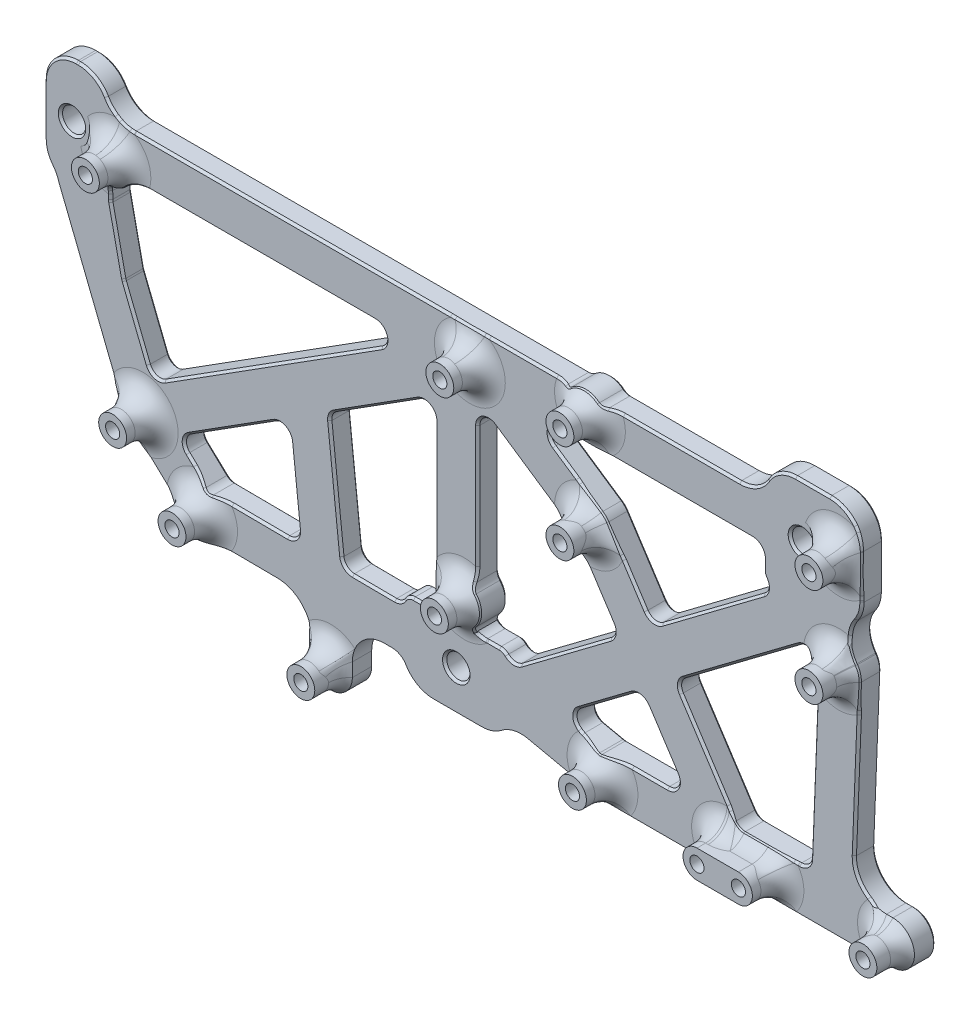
SolidWorks part; units mm, degrees
ref_plane "Płaszczyzna przednia" through (0, 0, 0) normal (0, 0, 1) x (1, 0, 0)
ref_plane "Płaszczyzna górna" through (0, 0, 0) normal (0, 1, 0) x (1, 0, 0)
ref_plane "Płaszczyzna prawa" through (0, 0, 0) normal (1, 0, 0) x (0, 0, -1)
sketch "Szkic1" plane through (0, 0, 0) normal (0, 0, 1) x (1, 0, 0)
  line L0 (-105.8745, -82.9771) -> (-66.5294, -60.2613)
  line L1 (-66.0294, -60.1273) -> (0.7574, -60.1273)
  line L2 (1.2574, -60.2613) -> (40.6024, -82.9771)
  line L3 (157.1383, 126.869) -> (14.6383, -119.9483)
  line L4 (-222.4104, 126.869) -> (-79.9104, -119.9483)
  line L5 (-175.136, 208.7505) -> (109.864, 208.7505)
  line L6 (64.864, 167.3188) -> (64.864, 212.7505)
  line L7 (98.3913, 108.9797) -> (64.9979, 166.8188)
  line L8 (138.1024, 85.8978) -> (98.7574, 108.6137)
  line L9 (-164.0313, 108.6148) -> (-203.3763, 85.8989)
  line L10 (-148.7185, 135.1579) -> (-141.0185, 148.4947)
  line L11 (-130.136, 212.7505) -> (-130.136, 167.3188)
  line L12 (-47.636, 83.7505) -> (-47.636, 178.7505)
  line L13 (-14.8648, 78.9507) -> (67.4076, 31.4507)
  line L14 (-29.8648, 52.97) -> (52.4076, 5.47)
  line L15 (-117.6796, 5.47) -> (-35.4072, 52.97)
  line L16 (-50.4072, 78.9507) -> (-132.6796, 31.4507)
  line L17 (37.7183, 110.8602) -> (37.7183, 136.4102)
  line L18 (37.7183, 136.4102) -> (71.4183, 136.4102)
  line L19 (71.4183, 136.4102) -> (71.4183, 110.8602)
  line L20 (71.4183, 110.8602) -> (37.7183, 110.8602)
  line L21 (-0.9299, 110.8602) -> (-0.9299, 136.4102)
  line L22 (-0.9299, 136.4102) -> (32.7701, 136.4102)
  line L23 (32.7701, 136.4102) -> (32.7701, 110.8602)
  line L24 (32.7701, 110.8602) -> (-0.9299, 110.8602)
  line L25 (56.9957, 168.9767) -> (-2.0043, 168.9767)
  line L26 (-5.0043, 171.9767) -> (-5.0043, 195.9767)
  line L27 (-2.0043, 198.9767) -> (56.9957, 198.9767)
  line L28 (59.9957, 195.9767) -> (59.9957, 171.9767)
  line L29 (-130.136, -7.5388) -> (-130.136, 102.4612)
  line L30 (-130.136, 102.4612) -> (64.864, 102.4612)
  line L31 (64.864, 102.4612) -> (64.864, -7.5388)
  line L32 (64.864, -7.5388) -> (-130.136, -7.5388)
  line L33 (-175.136, 178.7505) -> (109.864, 178.7505)
  line L34 (-196.4296, 141.869) -> (-53.9296, -104.9483)
  line L35 (131.1576, 141.869) -> (-11.3424, -104.9483)
  line L36 (-117.1006, 190.7261) -> (-117.1006, 155.6625)
  line L37 (-113.9256, 193.9011) -> (-117.1006, 190.7261)
  line L38 (-15.5006, 193.9011) -> (-113.9256, 193.9011)
  line L39 (-15.5006, 140.6881) -> (-15.5006, 193.9011)
  line L40 (-112.5695, 140.6881) -> (-15.5006, 140.6881)
  line L41 (-114.8555, 142.9741) -> (-112.5695, 140.6881)
  line L42 (-114.8555, 153.4174) -> (-114.8555, 142.9741)
  line L43 (-117.1006, 155.6625) -> (-114.8555, 153.4174)
  line L44 (-79.0859, -20.1918) -> (-82.0859, -20.1918)
  line L45 (-82.0859, -20.1918) -> (-82.0859, -34.6918)
  line L46 (-82.0859, -34.6918) -> (-79.0859, -34.6918)
  line L47 (-79.0859, -34.6918) -> (-79.0859, -37.6918)
  line L48 (-79.0859, -37.6918) -> (-82.0859, -37.6918)
  line L49 (-82.0859, -37.6918) -> (-82.0859, -37.9418)
  line L50 (-82.0859, -37.9418) -> (-39.0859, -37.9418)
  line L51 (-39.0859, -37.9418) -> (-39.0859, -37.6918)
  line L52 (-39.0859, -37.6918) -> (-42.0859, -37.6918)
  line L53 (-42.0859, -37.6918) -> (-42.0859, -34.6918)
  line L54 (-42.0859, -34.6918) -> (-39.0859, -34.6918)
  line L55 (-39.0859, -34.6918) -> (-39.0859, -20.1918)
  line L56 (-39.0859, -20.1918) -> (-42.0859, -20.1918)
  line L57 (-42.0859, -20.1918) -> (-42.0859, -17.1918)
  line L58 (-42.0859, -17.1918) -> (-39.0859, -17.1918)
  line L59 (-39.0859, -17.1918) -> (-39.0859, -16.9418)
  line L60 (-39.0859, -16.9418) -> (-82.0859, -16.9418)
  line L61 (-82.0859, -16.9418) -> (-82.0859, -17.1918)
  line L62 (-82.0859, -17.1918) -> (-79.0859, -17.1918)
  line L63 (-79.0859, -17.1918) -> (-79.0859, -20.1918)
  line L64 (-95.3418, 129.3922) -> (-98.3418, 129.3922)
  line L65 (-98.3418, 129.3922) -> (-98.3418, 114.8922)
  line L66 (-98.3418, 114.8922) -> (-95.3418, 114.8922)
  line L67 (-95.3418, 114.8922) -> (-95.3418, 111.8922)
  line L68 (-95.3418, 111.8922) -> (-98.3418, 111.8922)
  line L69 (-98.3418, 111.8922) -> (-98.3418, 111.6422)
  line L70 (-98.3418, 111.6422) -> (-55.3418, 111.6422)
  line L71 (-55.3418, 111.6422) -> (-55.3418, 111.8922)
  line L72 (-55.3418, 111.8922) -> (-58.3418, 111.8922)
  line L73 (-58.3418, 111.8922) -> (-58.3418, 114.8922)
  line L74 (-58.3418, 114.8922) -> (-55.3418, 114.8922)
  line L75 (-55.3418, 114.8922) -> (-55.3418, 129.3922)
  line L76 (-55.3418, 129.3922) -> (-58.3418, 129.3922)
  line L77 (-58.3418, 129.3922) -> (-58.3418, 132.3922)
  line L78 (-58.3418, 132.3922) -> (-55.3418, 132.3922)
  line L79 (-55.3418, 132.3922) -> (-55.3418, 132.6422)
  line L80 (-55.3418, 132.6422) -> (-98.3418, 132.6422)
  line L81 (-98.3418, 132.6422) -> (-98.3418, 132.3922)
  line L82 (-98.3418, 132.3922) -> (-95.3418, 132.3922)
  line L83 (-95.3418, 132.3922) -> (-95.3418, 129.3922)
  line L84 (-17.636, 83.7505) -> (-17.636, 178.7505)
  line L85 (-30.1502, 114.2977) -> (-35.3071, 114.2977)
  line L86 (-19.5841, -17.3004) -> (-19.5841, -42.8504)
  line L87 (-19.5841, -42.8504) -> (14.1159, -42.8504)
  line L88 (14.1159, -42.8504) -> (14.1159, -17.3004)
  line L89 (14.1159, -17.3004) -> (-19.5841, -17.3004)
  circle A0 centre (-17.2341, -30.0754) radius 1.65
  circle A1 centre (11.7659, -30.0754) radius 1.65
  circle A2 centre (-68.636, 7.4612) radius 1.65
  circle A3 centre (-68.636, 92.4612) radius 1.65
  circle A4 centre (56.364, 7.4612) radius 1.65
  circle A5 centre (56.364, 92.4612) radius 1.65
  circle A6 centre (61.864, 97.4612) radius 2
  circle A7 centre (-125.136, -2.5388) radius 2
  circle A8 centre (40.0683, 123.6352) radius 1.65
  circle A9 centre (69.0683, 123.6352) radius 1.65
  circle A10 centre (30.4201, 123.6352) radius 1.65
  circle A11 centre (1.4201, 123.6352) radius 1.65
  circle A12 centre (-1.5043, 195.4767) radius 1.25
  circle A13 centre (-1.5043, 172.4767) radius 1.25
  circle A14 centre (56.4957, 195.4767) radius 1.25
  circle A15 centre (56.4957, 172.4767) radius 1.25
  arc A16 (-5.0043, 171.9767) -> (-2.0043, 168.9767) centre (-2.0043, 171.9767) ccw
  arc A17 (-2.0043, 198.9767) -> (-5.0043, 195.9767) centre (-2.0043, 195.9767) ccw
  arc A18 (59.9957, 195.9767) -> (56.9957, 198.9767) centre (56.9957, 195.9767) ccw
  arc A19 (56.9957, 168.9767) -> (59.9957, 171.9767) centre (56.9957, 171.9767) ccw
  circle A20 centre (-105.6706, 143.1011) radius 1.5875
  circle A21 centre (-112.0206, 191.3611) radius 1.5875
  circle A22 centre (-29.4706, 191.3611) radius 1.5875
  circle A23 centre (-30.7406, 143.1011) radius 1.5875
  circle A24 centre (-75.5859, -19.4418) radius 1.5
  circle A25 centre (-45.5859, -35.4418) radius 1.5
  circle A26 centre (-32.636, 109.1294) radius 2.7
  arc A27 (-35.3071, 114.2977) -> (-45.2107, 105.6825) centre (-35.3071, 104.2977) ccw
  arc A28 (-21.6955, 109.638) -> (-30.1502, 114.2977) centre (-30.1502, 104.2977) ccw
  circle A29 centre (-61.8418, 114.1422) radius 1.5
  circle A30 centre (-91.8418, 130.1422) radius 1.5
  dimension "D1" = 30
sketch "Szkic2" plane through (0, 0, 0) normal (0, 0, 1) x (1, 0, 0)
  line L0 (-175.136, 208.7505) -> (109.864, 208.7505) construction
  line L1 (-30.1502, 114.2977) -> (-35.3071, 114.2977) construction
  line L2 (-130.136, 212.7505) -> (-130.136, 167.3188) construction
  line L3 (64.864, 167.3188) -> (64.864, 212.7505) construction
  line L4 (-128.636, 206.2505) -> (-128.636, 181.2505)
  line L5 (-128.636, 181.2505) -> (-113.136, 181.2505)
  line L6 (-113.136, 181.2505) -> (-113.136, 188.7505)
  line L7 (-113.136, 188.7505) -> (-37.636, 188.7505)
  line L8 (-37.636, 188.7505) -> (-37.636, 137.2977)
  line L9 (-37.636, 137.2977) -> (-45.136, 137.2977)
  line L10 (-45.136, 137.2977) -> (-45.136, 119.2977)
  line L11 (-45.136, 119.2977) -> (-20.136, 119.2977)
  line L12 (-20.136, 119.2977) -> (-20.136, 137.2977)
  line L13 (-20.136, 137.2977) -> (-27.636, 137.2977)
  line L14 (-27.636, 137.2977) -> (-27.636, 188.7505)
  line L15 (-27.636, 188.7505) -> (38.864, 188.7505)
  line L16 (38.864, 188.7505) -> (38.864, 181.2505)
  line L17 (38.864, 181.2505) -> (61.864, 181.2505)
  line L18 (61.864, 181.2505) -> (61.864, 206.2505)
  line L19 (61.864, 206.2505) -> (38.864, 206.2505)
  line L20 (38.864, 206.2505) -> (38.864, 198.7505)
  line L21 (38.864, 198.7505) -> (-113.136, 198.7505)
  line L22 (-113.136, 198.7505) -> (-113.136, 206.2505)
  line L23 (-113.136, 206.2505) -> (-128.636, 206.2505)
  line L24 (-128.636, 193.7505) -> (-122.136, 193.7505) construction
  line L25 (-32.636, 128.2977) -> (-32.636, 119.2977) construction
  line L26 (47.864, 193.7505) -> (61.864, 193.7505) construction
  circle A0 centre (-122.136, 193.7505) radius 2.7
  circle A1 centre (47.864, 193.7505) radius 2.7
  circle A2 centre (-32.636, 128.2977) radius 2.7
  dimension "D1" = 5.4
  dimension "D2" = 15
  dimension "D3" = 14
  dimension "D4" = 8
  dimension "D5" = 17
  dimension "D6" = 25
  dimension "D7" = 10
  dimension "D8" = 9
  dimension "D9" = 9
  dimension "D10" = 6.5
  dimension "D11" = 9
  dimension "D12" = 9
  dimension "D13" = 14
extrude "Dodanie-wyciągnięcie1" add sketch "Szkic2" along normal blind 5
sketch "Szkic3" plane through (0, 0, 5) normal (0, 0, 1) x (1, 0, 0)
  line L0 (-120.886, 181.2505) -> (-45.136, 128.2977) construction
  line L1 (-128.636, 181.2505) -> (-113.136, 181.2505) construction
  line L2 (-45.136, 137.2977) -> (-45.136, 119.2977) construction
  line L3 (-118.0213, 185.3485) -> (-42.2713, 132.3957)
  line L4 (-123.7507, 177.1526) -> (-48.0007, 124.1997)
  line L5 (-20.136, 128.2977) -> (50.364, 181.2505) construction
  line L6 (-20.136, 119.2977) -> (-20.136, 137.2977) construction
  line L7 (38.864, 181.2505) -> (61.864, 181.2505) construction
  line L8 (-23.1388, 132.2956) -> (47.3612, 185.2484)
  line L9 (-17.1332, 124.2999) -> (53.3668, 177.2527)
  arc A0 (-118.0213, 185.3485) -> (-123.7507, 177.1526) centre (-120.886, 181.2505) ccw
  arc A1 (-48.0007, 124.1997) -> (-42.2713, 132.3957) centre (-45.136, 128.2977) ccw
  arc A2 (-23.1388, 132.2956) -> (-17.1332, 124.2999) centre (-20.136, 128.2977) ccw
  arc A3 (53.3668, 177.2527) -> (47.3612, 185.2484) centre (50.364, 181.2505) ccw
  point P6 (-83.011, 154.7741)
  point P11 (15.114, 154.7741)
  dimension "D1" = 5
  dimension "D2" = 5
extrude "Dodanie-wyciągnięcie2" add sketch "Szkic3" against normal up to surface (5 mm away)
sketch "Szkic4" plane through (0, 0, 5) normal (0, 0, 1) x (1, 0, 0)
  line L0 (69.0683, 123.6352) -> (1.4201, 123.6352) construction
  line L1 (69.0683, 118.6352) -> (1.4201, 118.6352)
  line L2 (69.0683, 128.6352) -> (1.4201, 128.6352)
  line L3 (-61.8418, 114.1422) -> (-91.8418, 130.1422) construction
  line L4 (-64.1948, 109.7304) -> (-94.1948, 125.7304)
  line L5 (-59.4889, 118.554) -> (-89.4889, 134.554)
  arc A0 (69.0683, 118.6352) -> (69.0683, 128.6352) centre (69.0683, 123.6352) ccw
  arc A1 (1.4201, 128.6352) -> (1.4201, 118.6352) centre (1.4201, 123.6352) ccw
  arc A2 (-64.1948, 109.7304) -> (-59.4889, 118.554) centre (-61.8418, 114.1422) ccw
  arc A3 (-89.4889, 134.554) -> (-94.1948, 125.7304) centre (-91.8418, 130.1422) ccw
  circle A4 centre (-105.6706, 143.1011) radius 5
  circle A5 centre (-1.5043, 172.4767) radius 5
  circle A6 centre (56.4957, 172.4767) radius 5
  circle A7 centre (-1.5043, 195.4767) radius 5
  circle A8 centre (-29.4706, 191.3611) radius 5
  circle A9 centre (-30.7406, 143.1011) radius 5
  circle A10 centre (-112.0206, 191.3611) radius 5
  point P4 (35.2442, 123.6352)
  point P9 (-76.8418, 122.1422)
  dimension "D3" = 10
  dimension "D1" = 10
  dimension "D2" = 10
extrude "Dodanie-wyciągnięcie3" add sketch "Szkic4" against normal up to surface (5 mm away)
sketch "Szkic5" plane through (0, 0, 5) normal (0, 0, 1) x (1, 0, 0)
  line L0 (-91.8418, 130.1422) -> (-105.6706, 143.1011) construction
  line L1 (-95.2607, 126.4938) -> (-109.0895, 139.4527)
  line L2 (-88.4229, 133.7906) -> (-102.2517, 146.7495)
  line L3 (-61.8418, 114.1422) -> (-45.136, 128.2977) construction
  line L4 (-65.0742, 117.9569) -> (-48.3684, 132.1124)
  line L5 (-58.6095, 110.3275) -> (-41.9037, 124.483)
  line L6 (1.4201, 123.6352) -> (-20.136, 128.2977) construction
  line L7 (0.3631, 118.7482) -> (-21.1931, 123.4107)
  line L8 (2.4772, 128.5222) -> (-19.079, 133.1847)
  line L9 (30.4201, 123.6352) -> (-1.5043, 172.4767) construction
  line L10 (26.2348, 120.8995) -> (-5.6896, 169.7411)
  line L11 (34.6054, 126.3708) -> (2.6809, 175.2123)
  line L12 (54.5683, 123.6352) -> (56.4957, 172.4767) construction
  line L13 (49.5722, 123.8323) -> (51.4996, 172.6739)
  line L14 (59.5644, 123.438) -> (61.4918, 172.2796)
  line L15 (40.0683, 123.6352) -> (69.0683, 123.6352) construction
  arc A0 (-95.2607, 126.4938) -> (-88.4229, 133.7906) centre (-91.8418, 130.1422) ccw
  arc A1 (-102.2517, 146.7495) -> (-109.0895, 139.4527) centre (-105.6706, 143.1011) ccw
  arc A2 (-65.0742, 117.9569) -> (-58.6095, 110.3275) centre (-61.8418, 114.1422) ccw
  arc A3 (-41.9037, 124.483) -> (-48.3684, 132.1124) centre (-45.136, 128.2977) ccw
  arc A4 (0.3631, 118.7482) -> (2.4772, 128.5222) centre (1.4201, 123.6352) ccw
  arc A5 (-19.079, 133.1847) -> (-21.1931, 123.4107) centre (-20.136, 128.2977) ccw
  arc A6 (26.2348, 120.8995) -> (34.6054, 126.3708) centre (30.4201, 123.6352) ccw
  arc A7 (2.6809, 175.2123) -> (-5.6896, 169.7411) centre (-1.5043, 172.4767) ccw
  arc A8 (49.5722, 123.8323) -> (59.5644, 123.438) centre (54.5683, 123.6352) ccw
  arc A9 (61.4918, 172.2796) -> (51.4996, 172.6739) centre (56.4957, 172.4767) ccw
  point P4 (-98.7562, 136.6216)
  point P9 (-53.4889, 121.22)
  point P18 (-9.358, 125.9665)
  point P29 (14.4579, 148.0559)
  point P36 (55.532, 148.0559)
  point P48 (54.5683, 123.6352)
  dimension "D1" = 5
  dimension "D2" = 5
  dimension "D3" = 5
  dimension "D4" = 5
  dimension "D5" = 5
extrude "Dodanie-wyciągnięcie4" add sketch "Szkic5" against normal up to surface (5 mm away)
sketch "Szkic6" plane through (0, 0, 5) normal (0, 0, 1) x (1, 0, 0)
  line L0 (-1.5043, 172.4767) -> (-29.4706, 191.3611) construction
  line L1 (-4.3024, 168.333) -> (-32.2687, 187.2173)
  line L2 (1.2938, 176.6205) -> (-26.6725, 195.5048)
  line L3 (56.4957, 172.4767) -> (50.364, 181.2505) construction
  line L4 (52.3973, 169.6125) -> (46.2656, 178.3864)
  line L5 (60.594, 175.3409) -> (54.4623, 184.1147)
  line L6 (-105.6706, 143.1011) -> (-120.886, 181.2505) construction
  line L7 (-110.3148, 141.2488) -> (-125.5303, 179.3983)
  line L8 (-101.0264, 144.9534) -> (-116.2418, 183.1028)
  arc A0 (-4.3024, 168.333) -> (1.2938, 176.6205) centre (-1.5043, 172.4767) ccw
  arc A1 (-26.6725, 195.5048) -> (-32.2687, 187.2173) centre (-29.4706, 191.3611) ccw
  arc A2 (52.3973, 169.6125) -> (60.594, 175.3409) centre (56.4957, 172.4767) ccw
  arc A3 (54.4623, 184.1147) -> (46.2656, 178.3864) centre (50.364, 181.2505) ccw
  arc A4 (-110.3148, 141.2488) -> (-101.0264, 144.9534) centre (-105.6706, 143.1011) ccw
  arc A5 (-116.2418, 183.1028) -> (-125.5303, 179.3983) centre (-120.886, 181.2505) ccw
  point P4 (-15.4875, 181.9189)
  point P9 (53.4298, 176.8636)
  point P18 (-113.2783, 162.1758)
  dimension "D1" = 5
  dimension "D2" = 5
  dimension "D3" = 5
extrude "Dodanie-wyciągnięcie5" add sketch "Szkic6" against normal up to surface (5 mm away)
sketch "Szkic7" plane through (0, 0, 5) normal (0, 0, 1) x (1, 0, 0)
  line L0 (-110.0483, 167.5739) -> (-113.136, 181.9335)
  line L1 (-113.136, 181.9335) -> (-45.136, 134.3983)
  line L2 (-45.136, 134.3983) -> (-53.3191, 127.9175)
  line L3 (-53.3191, 127.9175) -> (-110.0483, 167.5739)
extrude "Wytnij-wyciągnięcie1" cut sketch "Szkic7" against normal through all
sketch "Szkic8" plane through (0, 0, 5) normal (0, 0, 1) x (1, 0, 0)
  line L0 (-29.4706, 191.3611) -> (-105.6706, 143.1011) construction
  line L1 (-26.7953, 187.137) -> (-102.9953, 138.877)
  line L2 (-32.1459, 195.5852) -> (-108.3459, 147.3252)
  line L3 (-67.5706, 167.2311) -> (-61.8418, 114.1422) construction
  line L4 (-62.5995, 167.7675) -> (-56.8707, 114.6786)
  line L5 (-72.5417, 166.6947) -> (-66.8129, 113.6058)
  arc A0 (-26.7953, 187.137) -> (-32.1459, 195.5852) centre (-29.4706, 191.3611) ccw
  arc A1 (-108.3459, 147.3252) -> (-102.9953, 138.877) centre (-105.6706, 143.1011) ccw
  arc A2 (-62.5995, 167.7675) -> (-72.5417, 166.6947) centre (-67.5706, 167.2311) ccw
  arc A3 (-66.8129, 113.6058) -> (-56.8707, 114.6786) centre (-61.8418, 114.1422) ccw
  point P4 (-67.5706, 167.2311)
  point P12 (-64.7062, 140.6866)
  dimension "D1" = 10
  dimension "D2" = 10
extrude "Dodanie-wyciągnięcie6" add sketch "Szkic8" against normal up to surface (5 mm away) contours A2 L2 A1 L1 L5 | A2 L4 L1 A0 L2 | L4 A2 L5 L1 | L5 A3 L4 L1
sketch "Szkic9" plane through (0, 0, 5) normal (0, 0, 1) x (1, 0, 0)
  line L0 (-45.136, 121.7441) -> (-45.136, 119.2977) construction
  line L1 (-106.7858, 125.1422) -> (-45.136, 125.1422)
  line L2 (-106.7858, 125.1422) -> (-106.7858, 105.8463)
  line L3 (-106.7858, 105.8463) -> (-45.136, 105.8463)
  line L4 (-45.136, 125.1422) -> (-45.136, 105.8463)
  dimension "D1" = 5
extrude "Wytnij-wyciągnięcie2" cut sketch "Szkic9" against normal through all
sketch "Szkic10" plane through (0, 0, 5) normal (0, 0, 1) x (1, 0, 0)
  line L0 (-45.136, 134.3983) -> (-45.136, 125.1422) construction
  line L1 (-91.8418, 130.1422) -> (-45.136, 129.7702) construction
  line L2 (-91.802, 135.142) -> (-45.0962, 134.7701)
  line L3 (-91.8816, 125.1424) -> (-45.1758, 124.7704)
  line L4 (-61.8418, 114.1422) -> (-61.8418, 129.9033) construction
  line L5 (-66.8418, 114.1422) -> (-66.8418, 129.9033)
  line L6 (-56.8418, 114.1422) -> (-56.8418, 129.9033)
  arc A0 (-91.802, 135.142) -> (-91.8816, 125.1424) centre (-91.8418, 130.1422) ccw
  arc A1 (-45.1758, 124.7704) -> (-45.0962, 134.7701) centre (-45.136, 129.7702) ccw
  arc A2 (-66.8418, 114.1422) -> (-56.8418, 114.1422) centre (-61.8418, 114.1422) ccw
  arc A3 (-56.8418, 129.9033) -> (-66.8418, 129.9033) centre (-61.8418, 129.9033) ccw
  point P4 (-68.4889, 129.9562)
  point P15 (-61.8418, 122.0227)
  dimension "D2" = 5
  dimension "D1" = 10
extrude "Dodanie-wyciągnięcie7" add sketch "Szkic10" against normal up to surface (5 mm away) contours A3 L2 A0 L3 L5 | A3 L6 L3 A1 L2 | L5 A2 L6 L3 | L6 A3 L5 L3
sketch "Szkic11" plane through (0, 0, 5) normal (0, 0, 1) x (1, 0, 0)
  circle A0 centre (-112.0206, 191.3611) radius 3.25
  circle A1 centre (-105.6706, 143.1011) radius 3.25
  circle A2 centre (-91.8418, 130.1422) radius 3.25
  circle A3 centre (-61.8418, 114.1422) radius 3.25
  circle A4 centre (-30.7406, 143.1011) radius 3.25
  circle A5 centre (1.4201, 123.6352) radius 3.25
  circle A6 centre (30.4201, 123.6352) radius 3.25
  circle A7 centre (40.0683, 123.6352) radius 3.25
  circle A8 centre (69.0683, 123.6352) radius 3.25
  circle A9 centre (56.4957, 172.4767) radius 3.25
  circle A11 centre (56.4957, 195.4767) radius 3.25
  circle A12 centre (-1.5043, 172.4767) radius 3.25
  circle A13 centre (-1.5043, 195.4767) radius 3.25
  circle A14 centre (-29.4706, 191.3611) radius 3.25
  dimension "D1" = 6.5
extrude "Dodanie-wyciągnięcie8" add sketch "Szkic11" along normal blind 7
fillet "Zaokrąglenie1" radius 7.5 12 edges at (-56.8418, 124.8633, 2.5) (-66.8418, 124.9429, 2.5) (-93.0918, 125.1422, 2.5) (-45.136, 119.2977, 2.5) (-20.136, 119.2977, 2.5) (59.7695, 128.6352, 2.5) (61.864, 181.2505, 2.5) (61.864, 206.2505, 2.5) (38.864, 206.2505, 2.5) (-113.136, 206.2505, 2.5) (-128.636, 206.2505, 2.5) (-128.636, 181.2505, 2.5)
fillet "Zaokrąglenie2" radius 7.5 6 edges at (38.864, 198.7505, 2.5) (56.464, 181.2505, 2.5) (-45.136, 124.7702, 2.5) (-20.136, 123.1821, 2.5) (-125.886, 181.2505, 2.5) (-113.136, 198.7505, 2.5)
sketch "Szkic12" plane through (0, 0, 5) normal (0, 0, 1) x (1, 0, 0)
  line L0 (-49.2821, 124.8031) -> (-45.1758, 124.7704) construction
  line L1 (-47.55, 124.7893) -> (-45.1758, 124.7704)
  arc A0 (-44.3583, 122.9589) -> (-47.55, 124.7893) centre (-47.5799, 121.0394) ccw
  arc A1 (-44.9772, 124.2719) -> (-37.9153, 119.2977) centre (-37.9153, 126.7977) ccw construction
  arc A2 (-44.9772, 124.2719) -> (-45.1758, 124.7704) centre (-52.039, 121.7461) ccw construction
  arc A3 (-44.9772, 124.2719) -> (-45.1758, 124.7704) centre (-52.039, 121.7461) ccw
  arc A4 (-44.9772, 124.2719) -> (-44.3583, 122.9589) centre (-37.9153, 126.7977) ccw
  dimension "D1" = 7.5
extrude "Dodanie-wyciągnięcie9" add sketch "Szkic12" against normal up to surface (5 mm away)
fillet "Zaokrąglenie3" radius 2.5 31 edges at (49.2296, 174.1452, 2.5) (51.4332, 170.9921, 2.5) (49.7617, 128.6352, 2.5) (33.1253, 128.6352, 2.5) (18.4765, 151.0465, 2.5) (-62.2655, 164.6726, 2.5) (-37.636, 180.2712, 2.5) (-37.636, 137.2977, 2.5) (-45.136, 137.2977, 2.5) (-59.0507, 134.8812, 2.5) (-69.1174, 134.9614, 2.5) (-71.6801, 158.71, 2.5) (-97.5386, 142.3329, 2.5) (-89.8484, 135.1265, 2.5) (-42.9374, 188.7505, 2.5) (-103.2576, 150.5477, 2.5) (-110.0483, 167.5739, 2.5) (-113.136, 181.9335, 2.5) (-107.7562, 188.7505, 2.5) (-113.136, 186.4871, 2.5) (-16.6699, 188.7505, 2.5) (38.864, 188.7505, 2.5) (38.864, 181.2505, 2.5) (12.9936, 159.4348, 2.5) (-20.136, 137.2977, 2.5) (-27.636, 139.1817, 2.5) (-27.636, 147.0205, 2.5) (-5.138, 168.8972, 2.5) (-27.636, 184.0891, 2.5) (2.2748, 198.7505, 2.5) (-5.2835, 198.7505, 2.5)
fillet "Zaokrąglenie4" radius 2.5 8 edges at (21.1786, 128.6352, 2.5) (10.4637, 145.028, 2.5) (-8.384, 130.8714, 2.5) (1.9547, 128.6352, 2.5) (-45.136, 134.7704, 2.5) (-27.636, 137.2977, 2.5) (42.0385, 181.2505, 2.5) (4.9808, 153.4164, 2.5)
fillet "Zaokrąglenie5" radius 2.5 1 edges at (-20.136, 134.551, 2.5)
sketch "Szkic14" plane through (0, 0, 5) normal (0, 0, 1) x (1, 0, 0)
  line L0 (30.4201, 123.6352) -> (40.0683, 123.6352) construction
  line L1 (30.4201, 126.8852) -> (40.0683, 126.8852)
  line L2 (30.4201, 120.3852) -> (40.0683, 120.3852)
  arc A0 (30.4201, 126.8852) -> (30.4201, 120.3852) centre (30.4201, 123.6352) ccw
  arc A1 (40.0683, 120.3852) -> (40.0683, 126.8852) centre (40.0683, 123.6352) ccw
  circle A2 centre (40.0683, 123.6352) radius 3.25 construction
  circle A3 centre (30.4201, 123.6352) radius 3.25 construction
  point P2 (35.2442, 123.6352)
extrude "Dodanie-wyciągnięcie10" add sketch "Szkic14" along normal blind 7
fillet "Zaokrąglenie6" radius 5 15 edges at (-4.7543, 195.4767, 5) (53.2457, 195.4767, 5) (53.2457, 172.4767, 5) (65.8183, 123.6352, 5) (-4.7543, 172.4767, 5) (-32.7206, 191.3611, 5) (-1.8299, 123.6352, 5) (27.1701, 123.6352, 5) (-65.0918, 114.1422, 5) (-33.9906, 143.1011, 5) (-115.2706, 191.3611, 5) (-108.9206, 143.1011, 5) (-95.0918, 130.1422, 5) (35.2442, 126.8852, 5) (43.3183, 123.6352, 5)
sketch "Szkic15" plane through (0, 0, 5) normal (0, 0, 1) x (1, 0, 0)
  circle A0 centre (47.864, 193.7505) radius 4.5
  circle A1 centre (-122.136, 193.7505) radius 4.5
  arc A2 (-119.5886, 194.6455) -> (-120.2584, 191.8104) centre (-122.136, 193.7505) ccw construction
  dimension "D1" = 9
extrude "Wytnij-wyciągnięcie3" cut sketch "Szkic15" along normal through all
hole_wizard "Otwór Ø3.3 (3.3)1" positions "Szkic16" profile "Szkic17" hole size "Ø3.3" standard "DIN"
sketch "Szkic16" plane through (0, 0, 12) normal (0, 0, 1) x (1, 0, 0)
  point P0 (-112.0206, 191.3611)
  point P3 (-105.6706, 143.1011)
  point P6 (-91.8418, 130.1422)
  point P9 (-61.8418, 114.1422)
  point P12 (-30.7406, 143.1011)
  point P15 (1.4201, 123.6352)
  point P18 (30.4201, 123.6352)
  point P21 (40.0683, 123.6352)
  point P24 (69.0683, 123.6352)
  point P27 (-1.5043, 172.4767)
  point P30 (-1.5043, 195.4767)
  point P33 (56.4957, 195.4767)
  point P36 (56.4957, 172.4767)
  point P40 (-29.4706, 191.3611)
sketch "Szkic17" plane through (-112.0206, 191.3611, 12) normal (1, 0, 0) x (0, -1, 0)
  line L0 (0, 0) -> (0, 12)
  line L1 (0, 12) -> (1.65, 12)
  line L2 (1.65, 12) -> (1.65, 0)
  line L5 (1.65, 0) -> (0, 0)
  line L11 (0, -6.35) -> (0, 107.95) construction
  dimension "Średnica otworu na wylot" = 3.3
  dimension "Głębokość otworu na wylot" = 12
sketch "Szkic18" plane through (0, 0, 0) normal (0, 0, -1) x (-1, 0, 0)
  line L1 (-56.4957, 192.1281) -> (-53.5957, 193.8024)
  line L2 (-53.5957, 193.8024) -> (-53.5957, 197.151)
  line L3 (-53.5957, 197.151) -> (-56.4957, 198.8253)
  line L4 (-56.4957, 198.8253) -> (-59.3957, 197.151)
  line L5 (-59.3957, 197.151) -> (-59.3957, 193.8024)
  line L6 (-59.3957, 193.8024) -> (-56.4957, 192.1281)
  line L7 (-56.4957, 169.1281) -> (-53.5957, 170.8024)
  line L8 (-53.5957, 170.8024) -> (-53.5957, 174.151)
  line L9 (-53.5957, 174.151) -> (-56.4957, 175.8253)
  line L10 (-56.4957, 175.8253) -> (-59.3957, 174.151)
  line L11 (-59.3957, 174.151) -> (-59.3957, 170.8024)
  line L12 (-59.3957, 170.8024) -> (-56.4957, 169.1281)
  line L13 (1.5043, 169.1281) -> (4.4043, 170.8024)
  line L14 (4.4043, 170.8024) -> (4.4043, 174.151)
  line L15 (4.4043, 174.151) -> (1.5043, 175.8253)
  line L16 (1.5043, 175.8253) -> (-1.3957, 174.151)
  line L17 (-1.3957, 174.151) -> (-1.3957, 170.8024)
  line L18 (-1.3957, 170.8024) -> (1.5043, 169.1281)
  line L19 (1.5043, 192.1281) -> (4.4043, 193.8024)
  line L20 (4.4043, 193.8024) -> (4.4043, 197.151)
  line L21 (4.4043, 197.151) -> (1.5043, 198.8253)
  line L22 (1.5043, 198.8253) -> (-1.3957, 197.151)
  line L23 (-1.3957, 197.151) -> (-1.3957, 193.8024)
  line L24 (-1.3957, 193.8024) -> (1.5043, 192.1281)
  line L25 (29.875, 188.037) -> (32.5516, 190.0493)
  line L26 (32.5516, 190.0493) -> (32.1472, 193.3734)
  line L27 (32.1472, 193.3734) -> (29.0662, 194.6852)
  line L28 (29.0662, 194.6852) -> (26.3896, 192.6729)
  line L29 (26.3896, 192.6729) -> (26.794, 189.3488)
  line L30 (26.794, 189.3488) -> (29.875, 188.037)
  line L31 (113.9213, 188.6041) -> (115.3585, 191.6286)
  line L32 (115.3585, 191.6286) -> (113.4579, 194.3856)
  line L33 (113.4579, 194.3856) -> (110.1199, 194.118)
  line L34 (110.1199, 194.118) -> (108.6827, 191.0935)
  line L35 (108.6827, 191.0935) -> (110.5833, 188.3366)
  line L36 (110.5833, 188.3366) -> (113.9213, 188.6041)
  line L37 (106.5317, 139.8651) -> (108.9036, 142.2288)
  line L38 (108.9036, 142.2288) -> (108.0425, 145.4649)
  line L39 (108.0425, 145.4649) -> (104.8095, 146.3371)
  line L40 (104.8095, 146.3371) -> (102.4376, 143.9733)
  line L41 (102.4376, 143.9733) -> (103.2987, 140.7373)
  line L42 (103.2987, 140.7373) -> (106.5317, 139.8651)
  line L43 (92.4294, 126.8455) -> (94.9906, 129.0027)
  line L44 (94.9906, 129.0027) -> (94.403, 132.2994)
  line L45 (94.403, 132.2994) -> (91.2542, 133.4389)
  line L46 (91.2542, 133.4389) -> (88.693, 131.2817)
  line L47 (88.693, 131.2817) -> (89.2806, 127.985)
  line L48 (89.2806, 127.985) -> (92.4294, 126.8455)
  line L49 (62.5969, 110.8798) -> (65.0447, 113.1649)
  line L50 (65.0447, 113.1649) -> (64.2896, 116.4273)
  line L51 (64.2896, 116.4273) -> (61.0868, 117.4046)
  line L52 (61.0868, 117.4046) -> (58.639, 115.1195)
  line L53 (58.639, 115.1195) -> (59.394, 111.8571)
  line L54 (59.394, 111.8571) -> (62.5969, 110.8798)
  line L55 (-66.6701, 121.2981) -> (-65.8452, 124.5435)
  line L56 (-65.8452, 124.5435) -> (-68.2434, 126.8806)
  line L57 (-68.2434, 126.8806) -> (-71.4665, 125.9723)
  line L58 (-71.4665, 125.9723) -> (-72.2914, 122.7268)
  line L59 (-72.2914, 122.7268) -> (-69.8932, 120.3897)
  line L60 (-69.8932, 120.3897) -> (-66.6701, 121.2981)
  line L61 (-38.1088, 120.9197) -> (-36.7369, 123.9744)
  line L62 (-36.7369, 123.9744) -> (-38.6964, 126.6899)
  line L63 (-38.6964, 126.6899) -> (-42.0278, 126.3506)
  line L64 (-42.0278, 126.3506) -> (-43.3997, 123.2959)
  line L65 (-43.3997, 123.2959) -> (-41.4402, 120.5805)
  line L66 (-41.4402, 120.5805) -> (-38.1088, 120.9197)
  line L67 (-28.6915, 120.7672) -> (-27.0721, 123.6982)
  line L68 (-27.0721, 123.6982) -> (-28.8007, 126.5662)
  line L69 (-28.8007, 126.5662) -> (-32.1487, 126.5031)
  line L70 (-32.1487, 126.5031) -> (-33.7681, 123.5721)
  line L71 (-33.7681, 123.5721) -> (-32.0395, 120.7042)
  line L72 (-32.0395, 120.7042) -> (-28.6915, 120.7672)
  line L73 (-0.0411, 120.5837) -> (1.9121, 123.3037)
  line L74 (1.9121, 123.3037) -> (0.5331, 126.3552)
  line L75 (0.5331, 126.3552) -> (-2.7991, 126.6867)
  line L76 (-2.7991, 126.6867) -> (-4.7523, 123.9666)
  line L77 (-4.7523, 123.9666) -> (-3.3733, 120.9151)
  line L78 (-3.3733, 120.9151) -> (-0.0411, 120.5837)
  line L79 (32.2694, 140.1218) -> (34.0851, 142.9354)
  line L80 (34.0851, 142.9354) -> (32.5563, 145.9147)
  line L81 (32.5563, 145.9147) -> (29.2118, 146.0804)
  line L82 (29.2118, 146.0804) -> (27.3961, 143.2668)
  line L83 (27.3961, 143.2668) -> (28.9248, 140.2875)
  line L84 (28.9248, 140.2875) -> (32.2694, 140.1218)
  circle A0 centre (-56.4957, 195.4767) radius 2.9 construction
  circle A1 centre (-56.4957, 172.4767) radius 2.9 construction
  circle A2 centre (1.5043, 172.4767) radius 2.9 construction
  circle A3 centre (1.5043, 195.4767) radius 2.9 construction
  circle A4 centre (29.4706, 191.3611) radius 2.9 construction
  circle A5 centre (112.0206, 191.3611) radius 2.9 construction
  circle A6 centre (105.6706, 143.1011) radius 2.9 construction
  circle A7 centre (91.8418, 130.1422) radius 2.9 construction
  circle A8 centre (61.8418, 114.1422) radius 2.9 construction
  circle A9 centre (-69.0683, 123.6352) radius 2.9 construction
  circle A10 centre (-40.0683, 123.6352) radius 2.9 construction
  circle A11 centre (-30.4201, 123.6352) radius 2.9 construction
  circle A12 centre (-1.4201, 123.6352) radius 2.9 construction
  circle A13 centre (30.7406, 143.1011) radius 2.9 construction
  dimension "D1" = 5.8
extrude "Wytnij-wyciągnięcie4" cut sketch "Szkic18" against normal blind 2.6
chamfer "Sfazowanie1" distance 0.6 angle 65 14 edges at (-3.1543, 172.4767, 2.6) (-31.1206, 191.3611, 2.6) (-3.1543, 195.4767, 2.6) (-113.6706, 191.3611, 2.6) (-107.3206, 143.1011, 2.6) (-93.4918, 130.1422, 2.6) (-63.4918, 114.1422, 2.6) (-32.3906, 143.1011, 2.6) (-0.2299, 123.6352, 2.6) (28.7701, 123.6352, 2.6) (38.4183, 123.6352, 2.6) (67.4183, 123.6352, 2.6) (54.8457, 172.4767, 2.6) (54.8457, 195.4767, 2.6)
chamfer "Sfazowanie2" distance 0.5 angle 45 207 edges at (-29.936, 128.2977, 0) (-119.436, 193.7505, 0) (50.564, 193.7505, 0) (1.9562, 128.6493, 0) (-0.6715, 129.2032, 0) (-4.9501, 131.6234, 0) (2.1602, 138.7912, 0) (10.2636, 143.8886, 0) (15.2872, 137.6485, 0) (18.7566, 129.9455, 0) (9.3899, 128.6352, 0) (-26.7972, 137.5118, 0) (-27.4727, 139.0059, 0) (-25.7406, 143.1011, 0) (-27.4727, 147.1963, 0) (-27.636, 163.7347, 0) (-26.3091, 181.592, 0) (-14.6464, 175.3178, 0) (-5.1738, 168.8619, 0) (-0.5813, 161.9259, 0) (-7.2807, 144.2067, 0) (-19.3228, 135.9071, 0) (-21.7022, 137.1168, 0) (-24.2106, 137.2977, 0) (13.1937, 160.5742, 0) (7.1072, 168.4405, 0) (2.0576, 175.9856, 0) (-4.3028, 180.3996, 0) (-10.8909, 186.9821, 0) (13.9318, 188.7505, 0) (38.1317, 188.0183, 0) (38.864, 185.0005, 0) (38.9851, 182.9819, 0) (39.7808, 180.4495, 0) (26.9691, 169.9318, 0) (49.091, 129.3329, 0) (40.9182, 128.6352, 0) (33.2882, 128.9364, 0) (26.0715, 139.4268, 0) (19.3881, 150.8864, 0) (33.755, 162.5222, 0) (49.0566, 173.0613, 0) (50.8314, 171.8533, 0) (51.3009, 170.9533, 0) (50.6282, 150.5939, 0) (-110.0398, 167.5765, 0) (-111.5863, 174.7265, 0) (-113.122, 181.935, 0) (-113.136, 183.0946, 0) (-112.5601, 185.5863, 0) (-109.6086, 186.9813, 0) (-107.5291, 188.5428, 0) (-79.0442, 188.7505, 0) (-49.1561, 186.9469, 0) (-75.4665, 168.1488, 0) (-102.8217, 151.8928, 0) (-107.1718, 160.3618, 0) (-58.4817, 135.5099, 0) (-60.6941, 150.1101, 0) (-61.8647, 164.4793, 0) (-51.2121, 171.673, 0) (-38.9306, 177.9189, 0) (-37.636, 157.7632, 0) (-38.3683, 138.03, 0) (-41.386, 137.2977, 0) (-43.8892, 136.961, 0) (-45.7289, 135.1169, 0) (-51.9086, 134.8243, 0) (-95.9615, 142.1839, 0) (-84.9414, 150.3112, 0) (-72.6489, 156.7012, 0) (-70.3339, 146.2347, 0) (-70.0506, 135.806, 0) (-80.3978, 135.0512, 0) (-89.7801, 135.2974, 0) (-92.8716, 137.9595, 0) (-41.6206, 120.2769, 0) (-32.3111, 119.2977, 0) (-24.2788, 119.7017, 0) (-19.1775, 122.2562, 0) (-7.7844, 120.5105, 0) (0.8886, 118.6635, 0) (35.2442, 118.6352, 0) (74.0683, 123.6352, 0) (68.3198, 128.6352, 0) (62.1645, 130.9375, 0) (60.7845, 154.3552, 0) (61.2936, 173.8838, 0) (60.5348, 175.4257, 0) (59.1231, 179.8224, 0) (61.5132, 186.1836, 0) (61.864, 193.6005, 0) (59.6673, 204.0539, 0) (50.364, 206.2505, 0) (42.614, 205.2457, 0) (37.1236, 199.7554, 0) (18.328, 198.7505, 0) (2.4343, 198.8988, 0) (-1.5043, 200.4767, 0) (-5.443, 198.8988, 0) (-56.9684, 198.7505, 0) (-111.3956, 199.7554, 0) (-116.886, 205.2457, 0) (-120.886, 206.2505, 0) (-126.4393, 204.0539, 0) (-128.636, 192.9026, 0) (-128.2169, 184.5826, 0) (-126.2212, 181.1763, 0) (-125.6114, 179.6163, 0) (-117.9226, 160.3235, 0) (-109.801, 140.2833, 0) (-102.1751, 132.9732, 0) (-94.7529, 126.077, 0) (-92.7927, 125.2934, 0) (-82.8072, 125.0701, 0) (-69.0174, 122.7846, 0) (-66.8418, 115.8223, 0) (-61.8418, 109.1422, 0) (-56.8418, 115.7228, 0) (-54.624, 122.6277, 0) (-48.416, 124.7962, 0) (-45.7143, 124.2924, 0) (55.0457, 192.9652, 0) (53.5957, 195.4767, 0) (55.0457, 197.9882, 0) (57.9457, 197.9882, 0) (59.3957, 195.4767, 0) (57.9457, 192.9652, 0) (-33.1773, 141.5286, 0) (-33.3207, 144.425, 0) (-30.8841, 145.9975, 0) (-28.3039, 144.6736, 0) (-28.1605, 141.7771, 0) (-30.5971, 140.2046, 0) (-0.9355, 121.9437, 0) (-1.2226, 124.8294, 0) (1.133, 126.5209, 0) (3.7757, 125.3266, 0) (4.0628, 122.4409, 0) (1.7072, 120.7494, 0) (27.8818, 122.2327, 0) (27.9364, 125.1322, 0) (30.4747, 126.5347, 0) (32.9584, 125.0376, 0) (32.9038, 122.1382, 0) (30.3655, 120.7357, 0) (37.4229, 122.447, 0) (37.7166, 125.3321, 0) (40.3621, 126.5202, 0) (42.7137, 124.8233, 0) (42.42, 121.9382, 0) (39.7745, 120.7501, 0) (66.2577, 122.9208, 0) (67.0443, 125.7121, 0) (69.855, 126.4264, 0) (71.8789, 124.3495, 0) (71.0923, 121.5583, 0) (68.2817, 120.8439, 0) (-63.8208, 112.0223, 0) (-64.6671, 114.7961, 0) (-62.6882, 116.9159, 0) (-59.8629, 116.2621, 0) (-59.0165, 113.4883, 0) (-60.9954, 111.3685, 0) (-93.71, 127.9241, 0) (-94.6968, 130.6511, 0) (-92.8286, 132.8691, 0) (-89.9736, 132.3603, 0) (-88.9868, 129.6333, 0) (-90.855, 127.4153, 0) (-107.7177, 141.047, 0) (-108.4731, 143.8469, 0) (-106.426, 145.901, 0) (-103.6235, 145.1552, 0) (-102.8681, 142.3553, 0) (-104.9152, 140.3012, 0) (-114.6399, 190.1164, 0) (-114.4082, 193.0071, 0) (-111.7889, 194.2518, 0) (-109.4013, 192.6058, 0) (-109.633, 189.7151, 0) (-112.2523, 188.4704, 0) (-31.2133, 189.0431, 0) (-32.3494, 191.7113, 0) (-30.6067, 194.0293, 0) (-27.7279, 193.6791, 0) (-26.5918, 191.0109, 0) (-28.3345, 188.6929, 0) (-2.9543, 192.9652, 0) (-4.4043, 195.4767, 0) (-2.9543, 197.9882, 0) (-0.0543, 197.9882, 0) (1.3957, 195.4767, 0) (-0.0543, 192.9652, 0) (-2.9543, 169.9652, 0) (-4.4043, 172.4767, 0) (-2.9543, 174.9882, 0) (-0.0543, 174.9882, 0) (1.3957, 172.4767, 0) (-0.0543, 169.9652, 0) (55.0457, 169.9652, 0) (53.5957, 172.4767, 0) (55.0457, 174.9882, 0) (57.9457, 174.9882, 0) (59.3957, 172.4767, 0) (57.9457, 169.9652, 0) (4.0692, 153.5765, 0)
chamfer "Sfazowanie3" distance 0.5 angle 45 179 edges at (1.6868, 199.3259, 3.3502) (-6.2911, 198.7505, 3.0709) (50.7116, 172.0246, 3.0702) (33.755, 162.5222, 5) (51.4, 170.1512, 3.1296) (46.9945, 128.6352, 5) (-60.6941, 150.1101, 5) (-51.2121, 171.673, 5) (-37.636, 161.6796, 5) (-41.386, 137.2977, 5) (-84.9414, 150.3112, 5) (-70.3339, 146.2347, 5) (-51.9086, 134.8243, 5) (-7.3909, 188.7505, 5) (38.864, 185.0005, 5) (8.9024, 165.6941, 5) (-16.7389, 176.7308, 5) (-23.7564, 137.2977, 5) (-75.4665, 168.1488, 5) (-107.1718, 160.3618, 5) (-111.5863, 174.7265, 5) (-113.136, 182.693, 5) (38.9851, 182.9819, 5) (-43.8892, 136.961, 5) (-90.5612, 135.7944, 3.072) (-106.5313, 188.7505, 2.9981) (-111.0975, 186.447, 3.3502) (-27.0042, 139.7785, 3.3502) (-27.636, 148.0849, 3.0509) (-4.8622, 168.4752, 3.2599) (47.6851, 172.8936, 5) (49.091, 129.3329, 5) (19.3881, 150.8864, 5) (-61.8647, 164.4793, 5) (-38.9306, 177.9189, 5) (-37.6819, 139.3209, 5) (-58.4817, 135.5099, 5) (-70.0506, 135.806, 5) (-72.6489, 156.7012, 5) (-95.9615, 142.1839, 5) (-49.1561, 186.9469, 5) (-102.8217, 151.8928, 5) (-110.0398, 167.5765, 5) (-113.122, 181.935, 5) (-10.8909, 186.9821, 5) (38.1317, 188.0183, 5) (13.1937, 160.5742, 5) (-26.3091, 181.592, 5) (-7.2807, 144.2067, 5) (15.2872, 137.6485, 5) (12.2701, 128.6352, 5) (2.1602, 138.7912, 5) (1.6934, 128.6917, 3.3233) (26.9691, 169.9318, 5) (4.0692, 153.5765, 5) (18.7566, 129.9455, 5) (10.2636, 143.8886, 5) (-45.7289, 135.1169, 5) (39.7808, 180.4495, 5) (-21.7022, 137.1168, 5) (-19.3228, 135.9071, 5) (-77.8759, 188.7505, 5) (-5.0049, 132.0343, 5) (-27.636, 165.0645, 5) (0.8001, 159.8124, 5) (4.4761, 172.4659, 5) (-7.022, 182.2357, 5) (-1.5043, 188.7505, 5) (19.8184, 188.7505, 5) (25.3794, 140.4857, 5) (50.5486, 148.5767, 5) (43.3494, 128.6352, 5) (-37.636, 143.7141, 5) (-38.7379, 137.7252, 5) (-78.582, 135.0368, 5) (-94.1967, 139.2012, 5) (61.864, 193.9814, 5) (58.1313, 205.2357, 5) (-17.4395, 198.7505, 5) (-29.4706, 198.7505, 5) (-70.3924, 198.7505, 5) (-109.76, 199.0547, 5) (-112.7934, 200.7961, 5) (-111.5304, 144.2964, 5) (-102.1751, 132.9732, 5) (-79.8009, 125.0462, 5) (-97.8617, 135.7834, 5) (-83.5921, 130.0765, 5) (-98.8554, 147.7504, 5) (-117.6676, 185.3466, 5) (-104.4212, 194.5722, 5) (-31.7303, 134.9107, 5) (-33.1936, 150.978, 5) (9.6701, 123.6352, 5) (-29.4706, 183.1111, 5) (-8.3415, 177.0936, 5) (3.0094, 165.571, 5) (6.4411, 193.2556, 5) (-9.4497, 193.2556, 5) (30.7105, 131.8852, 5) (48.3183, 123.6352, 5) (-7.0144, 198.7505, 5.3511) (-5.491, 198.882, 6.0052) (-1.5043, 200.4767, 6.2003) (2.163, 199.0152, 6.1202) (5.5622, 198.7505, 5.0214) (51.3452, 170.7794, 5.876) (49.2984, 173.0103, 5.1079) (-3.4807, 166.3617, 5.3444) (-5.2273, 168.9146, 6.0749) (-0.6677, 129.2024, 5.5626) (5.0847, 128.6352, 5.44) (-27.636, 148.6822, 5.3603) (-27.4954, 147.2582, 5.9823) (-25.7406, 143.1011, 6.2003) (-27.3313, 139.3134, 6.1202) (-27.0509, 137.6418, 5.2839) (-106.257, 188.7505, 5.3845) (-107.4068, 188.5922, 5.9051) (-109.6086, 186.9813, 6.2003) (-112.2558, 185.8943, 5.8429) (-87.7705, 125.1096, 5.3264) (-93.6297, 125.5178, 6.2367) (-94.7529, 126.077, 6.2003) (-97.3462, 128.4481, 5.6646) (-90.0257, 135.4114, 5.7767) (30.4201, 128.3496, 6.4645) (31.001, 128.3496, 6.4645) (1.2256, 191.633, 6.4645) (60.015, 197.5668, 6.8103) (59.5634, 191.8969, 6.4645) (0.571, 175.5502, 6.708) (1.5999, 174.5057, 6.708) (-31.567, 195.5838, 6.4645) (-34.7849, 140.6784, 6.4645) (-34.798, 141.1344, 6.6471) (-109.9732, 195.6078, 6.4645) (-108.2064, 140.395, 6.708) (-109.1153, 141.7272, 6.708) (-106.6953, 137.2091, 5) (2.0576, 175.9856, 5) (-1.4255, 178.4566, 5) (-109.801, 140.2833, 5) (-119.1381, 163.3712, 5) (-91.3323, 125.138, 3.3374) (61.864, 188.8314, 5) (50.364, 206.2505, 5) (-120.886, 206.2505, 5) (-128.636, 192.9026, 5) (-128.2169, 184.5826, 5) (-126.4393, 204.0539, 5) (42.614, 205.2457, 5) (61.6136, 200.6724, 5) (19.7209, 198.7505, 5) (61.5132, 186.1836, 5) (-125.6114, 179.6163, 5) (-116.886, 205.2457, 5) (37.1236, 199.7554, 5) (-126.2212, 181.1763, 5) (-108.0423, 198.761, 5)
chamfer "Sfazowanie4" distance 0.5 angle 45 6 edges at (61.2936, 173.8838, 5) (61.3624, 169.001, 5) (60.6551, 151.0767, 5)
chamfer "Sfazowanie5" distance 0.5 angle 45 5 edges at (-119.436, 193.7505, 5) (-29.936, 128.2977, 5)
